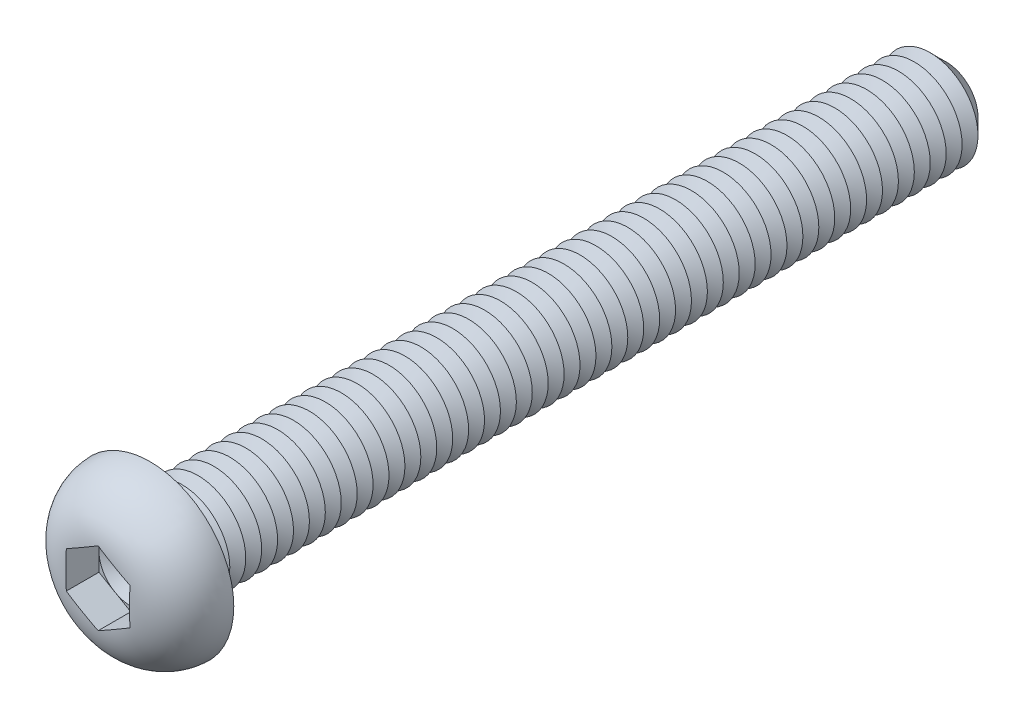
SolidWorks part; units mm, degrees
ref_plane "Front Plane" through (0, 0, 0) normal (0, 0, 1) x (1, 0, 0)
ref_plane "Top Plane" through (0, 0, 0) normal (0, 1, 0) x (1, 0, 0)
ref_plane "Right Plane" through (0, 0, 0) normal (1, 0, 0) x (0, 0, -1)
sketch "Sketch1" plane through (0, 0, 0) normal (1, 0, 0) x (0, 0, -1)
  line L0 (-47.9342, 0) -> (60.3146, 0) construction
sketch "Sketch2" plane through (0, 0, 0) normal (1, 0, 0) x (0, 0, -1)
  line L0 (0, 0) -> (-3.3, 0)
  line L1 (-47.9342, 0) -> (60.3146, 0) construction
  line L2 (-3.3, 0) -> (-3.3, 1.8515)
  line L3 (0, 5.25) -> (0, 0)
  arc A0 (-3.3, 1.8515) -> (0, 5.25) centre (0.1, 1.8515) cw
  dimension "D1" = 3.4
  dimension "D2" = 3.3
  dimension "D3" = 5.25
revolve "Revolve1" add sketch "Sketch2" angle 360 about L0
sketch "Sketch3" plane through (0, 0, 3.3) normal (0, 0, 1) x (1, 0, 0)
  line L1 (0, 2.3094) -> (-2, 1.1547)
  line L2 (-2, 1.1547) -> (-2, -1.1547)
  line L3 (-2, -1.1547) -> (0, -2.3094)
  line L4 (0, -2.3094) -> (2, -1.1547)
  line L5 (2, -1.1547) -> (2, 1.1547)
  line L6 (2, 1.1547) -> (0, 2.3094)
  circle A0 centre (0, 0) radius 2 construction
  dimension "D1" = 4
extrude "Cut-Extrude1" cut sketch "Sketch3" against normal blind 2.08
sketch "Sketch4" plane through (0, 0, 0) normal (0, 0, -1) x (-1, 0, 0)
  circle A0 centre (0, 0) radius 3
  dimension "D1" = 6
extrude "Boss-Extrude1" add sketch "Sketch4" along normal blind 50
chamfer "Chamfer1" distance 1 angle 45 1 edges at (-3, 0, -50)
sketch "Sketch5" plane through (0, 0, 0) normal (1, 0, 0) x (0, 0, -1)
  line L0 (1, 3) -> (2, 3)
  line L1 (49, 3) -> (0, 3) construction
  line L2 (2, 3) -> (1.5, 2.134)
  line L3 (1.5, 2.134) -> (1, 3)
  line L4 (0, -5.25) -> (0, 5.25) construction
  line L5 (49, 3) -> (0, 3) construction
  dimension "D1" = 1
  dimension "D2" = 1
revolve "Cut-Revolve1" cut sketch "Sketch5" angle 360 about L0
pattern_linear "LPattern1" count 48 spacing 1 along (0, 0, -1) of "Cut-Revolve1"
fillet "Fillet2" radius 0.5 1 edges at (-3, 0, 0)
sketch "Sketch6" plane through (0, 0, 1.22) normal (0, 0, 1) x (1, 0, 0)
  line L0 (0, -2.3094) -> (2, -1.1547) construction
  circle A0 centre (0, 0) radius 2
extrude "Cut-Extrude2" cut sketch "Sketch6" against normal through all draft 60
